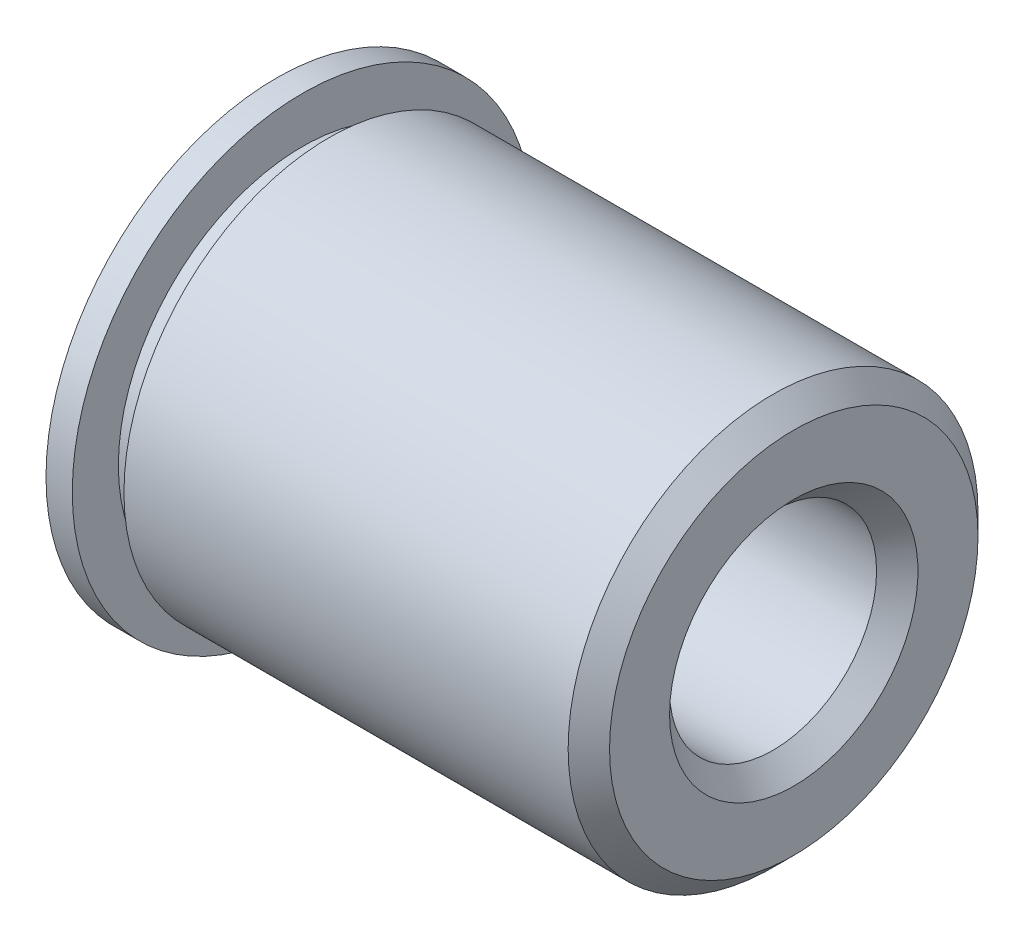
SolidWorks part; units mm, degrees
ref_plane "Front Plane" through (0, 0, 0) normal (0, 0, 1) x (1, 0, 0)
ref_plane "Top Plane" through (0, 0, 0) normal (0, 1, 0) x (1, 0, 0)
ref_plane "Right Plane" through (0, 0, 0) normal (1, 0, 0) x (0, 0, -1)
sketch "Sketch1" plane through (0, 0, 0) normal (0, 0, 1) x (1, 0, 0)
  line L0 (-67.8249, 0) -> (74.2137, 0) construction
  line L1 (74.2137, 0) -> (74.2137, 1.98)
  line L2 (74.2137, 1.98) -> (69.7217, 1.98)
  line L3 (69.7217, 1.98) -> (69.7217, 1.78)
  line L4 (69.7217, 1.78) -> (69.4677, 1.78)
  line L5 (69.4677, 1.78) -> (69.4677, 2.225)
  line L6 (69.4677, 2.225) -> (69.2137, 2.225)
  line L7 (69.2137, 2.225) -> (69.2137, 0)
  line L8 (69.2137, 0) -> (74.2137, 0)
  dimension "D1" = 1.98
  dimension "D2" = 5
  dimension "D3" = 0.254
  dimension "D4" = 0.254
  dimension "D5" = 0.2
  dimension "D6" = 2.225
revolve "Revolve1" add sketch "Sketch1" angle 360 about L0
sketch "Sketch2" plane through (74.2137, 0, 0) normal (1, 0, 0) x (0, 0, -1)
  circle A0 centre (0, 0) radius 1
  dimension "D1" = 2
extrude "Cut-Extrude1" cut sketch "Sketch2" against normal through all contours A0
chamfer "Chamfer1" distance 0.2 angle 45 1 edges at (74.2137, 0, 1.98)
chamfer "Chamfer2" distance 0.2 angle 45 2 edges at (69.2137, 0, -1) (74.2137, 0, -1)
